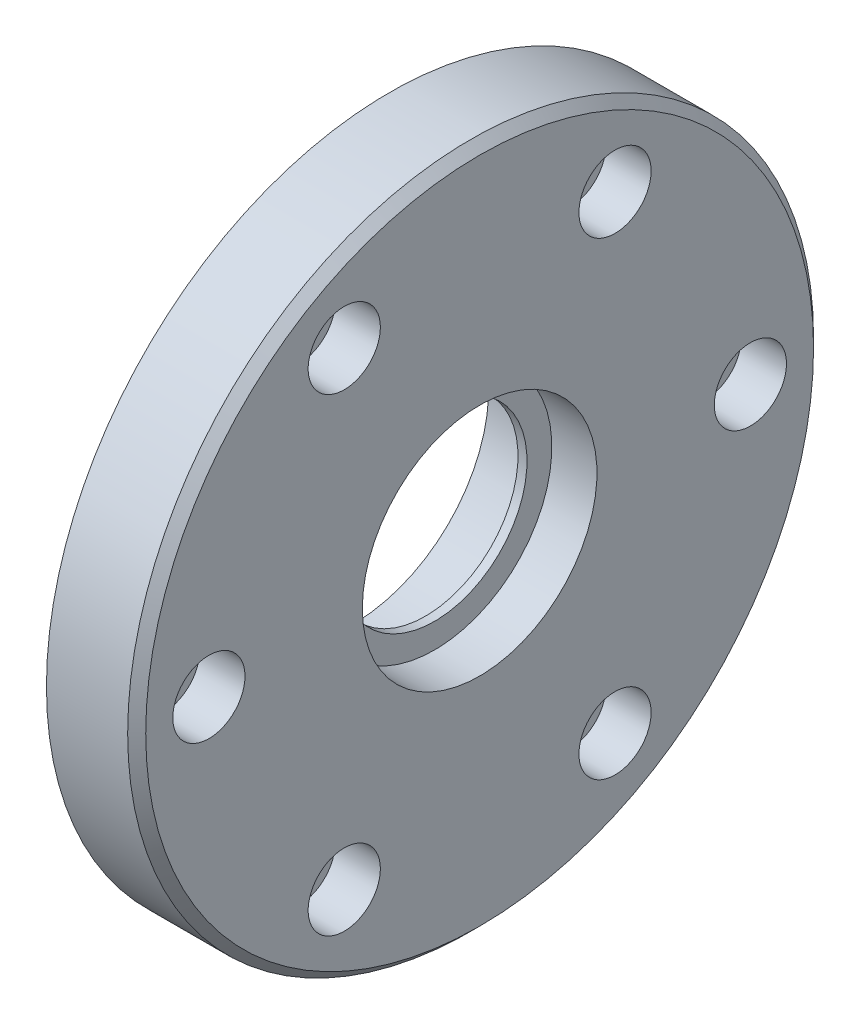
SolidWorks part; units mm, degrees
ref_plane "Plan1" through (0, 0, 0) normal (0, 0, 1) x (1, 0, 0)
ref_plane "Plan2" through (0, 0, 0) normal (0, 1, 0) x (1, 0, 0)
ref_plane "Plan3" through (0, 0, 0) normal (1, 0, 0) x (0, 0, -1)
sketch "Esquisse1" plane through (0, 0, 0) normal (0, 0, 1) x (1, 0, 0)
  line L0 (0, 0) -> (33, 0) construction
  line L1 (-4, 15) -> (4, 15)
  line L2 (4, 15) -> (4, 10.25)
  line L3 (4, 10.25) -> (5, 10.25)
  line L4 (10, 13) -> (10, 38)
  line L5 (10, 38) -> (0, 38)
  line L6 (0, 38) -> (0, 25)
  line L7 (0, 25) -> (-1, 25)
  line L8 (-4, 25) -> (-4, 15)
  line L9 (-2.5, 25) -> (-4, 25)
  line L11 (5, 10.25) -> (5, 13)
  line L12 (5, 13) -> (10, 13)
  line L13 (-2.5, 25) -> (-2.5, 24)
  line L14 (-2.5, 24) -> (-1, 24)
  line L15 (-1, 25) -> (-1, 24)
  dimension "D1" = 30
  dimension "D2" = 20.5
  dimension "D3" = 10
  dimension "D4" = 8
  dimension "D5" = 50
  dimension "D6" = 4
  dimension "D7" = 76
  dimension "D8" = 26
  dimension "D9" = 5
  dimension "D10" = 48
  dimension "D11" = 1.5
  dimension "D12" = 1.5
revolve "BASE" add sketch "Esquisse1" angle 360 about L0
chamfer "Chanfrein 1" distance 1 angle 45
hole_wizard "Chambrage pour vis à tête cylindrique à 6 pans creux (vis CHC) M41" positions "Esquisse3" profile "Esquisse2" counterbore size "M4" standard "ISO"
sketch "Esquisse3" plane through (10, 0, 0) normal (1, 0, 0) x (0, 0, -1)
  line L0 (30, 0) -> (0, 0) construction
  point P0 (30, 0)
  dimension "D1" = 30
sketch "Esquisse2" plane through (10, 0, -30) normal (0, 1, 0) x (0, 0, -1)
  line L0 (0, 0) -> (0, 14)
  line L1 (0, 14) -> (2.15, 14)
  line L3 (2.15, 14) -> (2.15, 5)
  line L4 (2.15, 5) -> (4, 5)
  line L5 (4, 5) -> (4, 0)
  line L7 (4, 0) -> (0, 0)
  line L11 (0, -6.35) -> (0, 107.95) construction
  dimension "Diamètre du perçage jusqu'au prochain" = 4.3
  dimension "Profondeur du perçage jusqu'au prochain" = 14
  dimension "Diamètre du chambrage" = 8
  dimension "Profondeur du chambrage" = 5
pattern_circular "Répétition circulaire1" count 6 over 360 about axis through (0, 0, 0) along (1, 0, 0)
chamfer "Chanfrein 0,5" distance 0.5 angle 45
